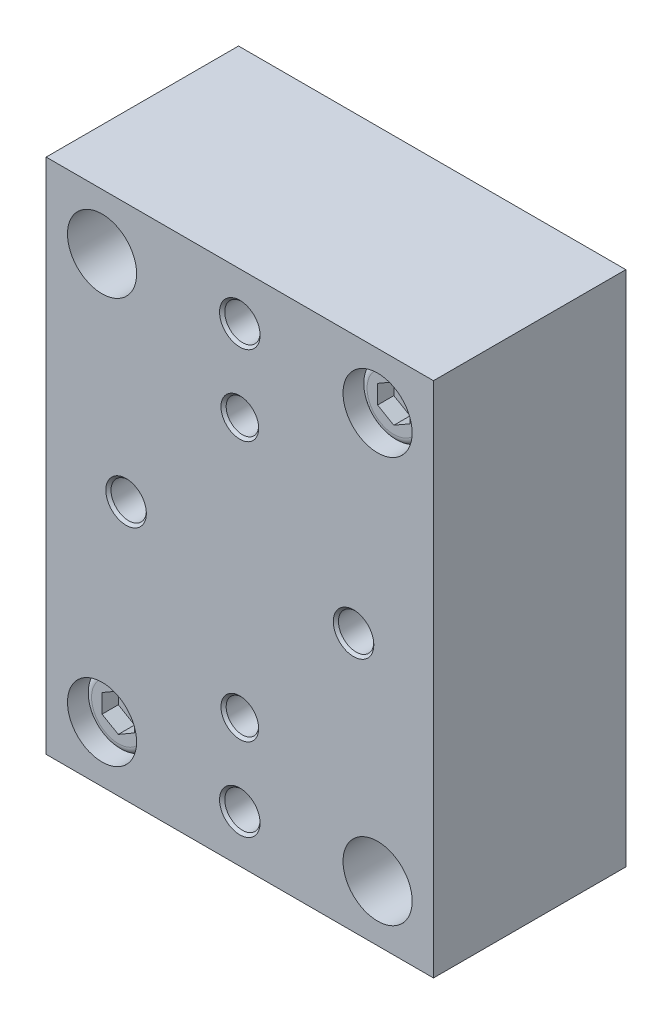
SolidWorks part; units mm, degrees
ref_plane "Front Plane" through (0, 0, 0) normal (0, 0, 1) x (1, 0, 0)
ref_plane "Top Plane" through (0, 0, 0) normal (0, 1, 0) x (1, 0, 0)
ref_plane "Right Plane" through (0, 0, 0) normal (1, 0, 0) x (0, 0, -1)
sketch "Sketch1" plane through (0, 0, 0) normal (0, 0, 1) x (1, 0, 0)
  line L0 (-18.923, 25.273) -> (18.923, -25.273) construction
  line L1 (-18.923, 25.273) -> (18.923, 25.273)
  line L2 (-18.923, 25.273) -> (-18.923, -25.273)
  line L3 (-18.923, -25.273) -> (18.923, -25.273)
  line L4 (18.923, 25.273) -> (18.923, -25.273)
  dimension "D1" = 37.846
  dimension "D2" = 50.546
extrude "Extrude1" add sketch "Sketch1" along normal blind 18.796
sketch "Sketch2" plane through (0, 0, 18.796) normal (0, 0, 1) x (1, 0, 0)
  line L0 (-13.462, 19.812) -> (13.462, -19.812) construction
  circle A0 centre (-13.462, 19.812) radius 3.3782
  circle A1 centre (13.462, 19.812) radius 3.3782
  circle A2 centre (-13.462, -19.812) radius 3.3782
  circle A3 centre (13.462, -19.812) radius 3.3782
  dimension "D1" = 6.7564
  dimension "D2" = 26.924
  dimension "D3" = 39.624
extrude "Cut-Extrude1" cut sketch "Sketch2" against normal through all
hole_wizard "Hole1" positions "Sketch4" profile "Sketch3" legacy
sketch "Sketch4" plane through (0, 0, 0) normal (0, 0, -1) x (-1, 0, 0)
  line L0 (0, 12.7) -> (0, -12.7) construction
  point P0 (0, 12.7)
  point P2 (0, -12.7)
  dimension "D1" = 25.4
sketch "Sketch3" plane through (0, 12.7, 0) normal (1, 0, 0) x (0, 1, 0)
  line L0 (0, 0) -> (0, 18.796)
  line L1 (0, 18.796) -> (1.5875, 18.796)
  line L2 (1.5875, 18.796) -> (1.5875, 3.175)
  line L3 (1.5875, 3.175) -> (2.9845, 3.175)
  line L4 (2.9845, 3.175) -> (2.9845, 0)
  line L5 (2.9845, 0) -> (0, 0)
  line L6 (0, 110) -> (0, -10) construction
  dimension "Diameter" = 3.175
  dimension "Depth" = 18.796
  dimension "C-Bore Diameter" = 5.969
  dimension "C-Bore Depth" = 3.175
hole_wizard "#8-32 Tapped Hole1" positions "Sketch6" profile "Sketch5" tap size "#8-32" standard "ANSI Inch"
sketch "Sketch6" plane through (0, 0, 18.796) normal (0, 0, 1) x (1, 0, 0)
  line L0 (0, 20.6375) -> (0, -20.6375) construction
  line L2 (-11.1125, 0) -> (11.1125, 0) construction
  point P0 (-11.1125, 0)
  point P2 (11.1125, 0)
  point P4 (0, 20.6375)
  point P6 (0, -20.6375)
  dimension "D1" = 41.275
  dimension "D2" = 22.225
sketch "Sketch5" plane through (-11.1125, 0, 18.796) normal (1, 0, 0) x (0, -1, 0)
  line L0 (0, 0) -> (0, 18.796)
  line L1 (0, 18.796) -> (1.7272, 18.796)
  line L2 (1.7272, 18.796) -> (1.7272, 0)
  line L5 (1.7272, 0) -> (0, 0)
  line L11 (0, -6.35) -> (0, 107.95) construction
  dimension "Thru Tap Drill Dia." = 3.4544
  dimension "Thru Tap Drill Depth" = 18.796
sketch "Sketch7" plane through (0, 0, 0) normal (0, 0, -1) x (-1, 0, 0)
  circle A4 centre (-13.462, 19.812) radius 3.3782 construction
  circle A5 centre (-13.462, 19.812) radius 3.3782
  circle A6 centre (13.462, -19.812) radius 3.3782 construction
  circle A7 centre (13.462, -19.812) radius 3.3782
extrude "Boss-Extrude1" add sketch "Sketch7" against normal offset from surface (17.2085 mm away) 1.5875 separate body
fillet "Fillet1" radius 0.762 1 edges at (16.8402, 19.812, 17.2085)
fillet "Fillet2" radius 0.762 1 edges at (-10.0838, -19.812, 17.2085)
sketch "Sketch8" plane through (0, 0, 17.2085) normal (0, 0, 1) x (1, 0, 0)
  line L1 (13.462, 21.6451) -> (11.8745, 20.7285)
  line L2 (11.8745, 20.7285) -> (11.8745, 18.8955)
  line L3 (11.8745, 18.8955) -> (13.462, 17.9789)
  line L4 (13.462, 17.9789) -> (15.0495, 18.8955)
  line L5 (15.0495, 18.8955) -> (15.0495, 20.7285)
  line L6 (15.0495, 20.7285) -> (13.462, 21.6451)
  line L7 (-13.462, -17.9789) -> (-15.0495, -18.8955)
  line L8 (-15.0495, -18.8955) -> (-15.0495, -20.7285)
  line L9 (-15.0495, -20.7285) -> (-13.462, -21.6451)
  line L10 (-13.462, -21.6451) -> (-11.8745, -20.7285)
  line L11 (-11.8745, -20.7285) -> (-11.8745, -18.8955)
  line L12 (-11.8745, -18.8955) -> (-13.462, -17.9789)
  circle A0 centre (13.462, 19.812) radius 1.5875 construction
  circle A1 centre (-13.462, -19.812) radius 1.5875 construction
  circle A2 centre (13.462, 19.812) radius 2.6162 construction
  circle A3 centre (-13.462, -19.812) radius 2.6162 construction
  dimension "D1" = 3.175
extrude "Cut-Extrude2" cut sketch "Sketch8" against normal blind 1.5875
chamfer "Chamfer1" distance 0.254 angle 45 6 edges at (-9.3853, 0, 18.796) (12.8397, 0, 18.796) (1.7272, -20.6375, 18.796) (-1.5875, -12.7, 18.796) (1.7272, 20.6375, 18.796) (-1.5875, 12.7, 18.796)
